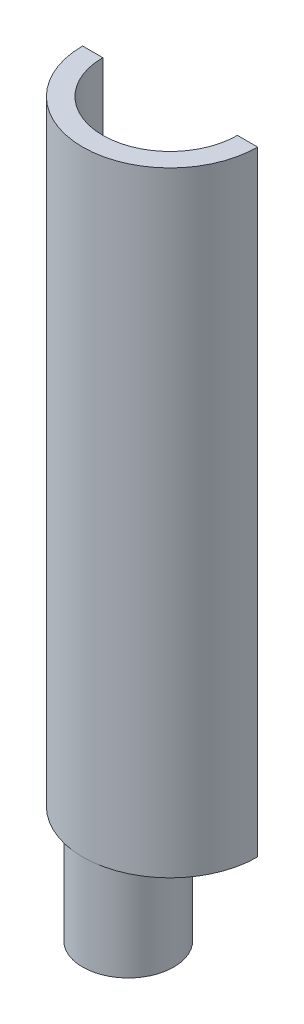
SolidWorks part; units mm, degrees
ref_plane "Front Plane" through (0, 0, 0) normal (1, 0, 0) x (0, 1, 0)
ref_plane "Top Plane" through (0, 0, 0) normal (0, 0, 1) x (0, 1, 0)
ref_plane "Right Plane" through (0, 0, 0) normal (0, 1, 0) x (-1, 0, 0)
sketch "Sketch1" plane through (0, 0, 0) normal (0, 1, 0) x (-1, 0, 0)
  line L0 (-8.255, 0) -> (-6.35, 0)
  line L1 (6.35, 0) -> (8.255, 0)
  arc A0 (8.255, 0) -> (-8.255, 0) centre (0, 0) ccw
  arc A1 (6.35, 0) -> (-6.35, 0) centre (0, 0) ccw
  dimension "D1" = 16.51
  dimension "D2" = 12.7
extrude "Boss-Extrude1" add sketch "Sketch1" along normal blind 58
sketch "Sketch2" plane through (0, 0, 0) normal (0, 1, 0) x (-1, 0, 0)
  line L0 (-8.255, 0) -> (8.255, 0)
  arc A1 (8.255, 0) -> (-8.255, 0) centre (0, 0) ccw
extrude "Boss-Extrude2" add sketch "Sketch2" along normal blind 1.4
sketch "Sketch4" plane through (0, 0, 0) normal (0, 1, 0) x (-1, 0, 0)
  line L0 (0, 0) -> (0, 8.255) construction
  line L1 (0, 0) -> (0, 8.255) construction
  line L2 (0, 0) -> (-1.6876, 0)
  line L4 (-6.35, 0) -> (6.35, 0) construction
  line L5 (0, 0) -> (1.6876, 0)
  arc A0 (1.6876, 0) -> (-1.6876, 0) centre (0, 3.955) ccw
  arc A1 (8.255, 0) -> (-8.255, 0) centre (0, 0) ccw construction
  circle A2 centre (0, 3.955) radius 3
  dimension "D1" = 8.6
  dimension "D2" = 6
extrude "Boss-Extrude3" add sketch "Sketch4" against normal blind 9
sketch "Sketch5" plane through (0, 0, 0) normal (0, 1, 0) x (-1, 0, 0)
  circle A2 centre (0, 3.955) radius 1
  dimension "D1" = 2
extrude "Cut-Extrude1" cut sketch "Sketch5" along normal blind 9
sketch "Sketch6" plane through (0, 0, 0) normal (0, 1, 0) x (-1, 0, 0)
  line L0 (-0.8319, 3.4) -> (-0.8319, 0)
  line L1 (-6.35, 0) -> (6.35, 0) construction
  line L2 (0.8319, 3.4) -> (0.8319, 0)
  line L3 (0.8319, 0) -> (-0.8319, 0)
  line L4 (-0.8319, 3.4) -> (0.8319, 3.4)
  circle A0 centre (0, 3.955) radius 1 construction
  dimension "D1" = 3.4
extrude "Cut-Extrude2" cut sketch "Sketch6" along normal blind 10 and the other way through all
